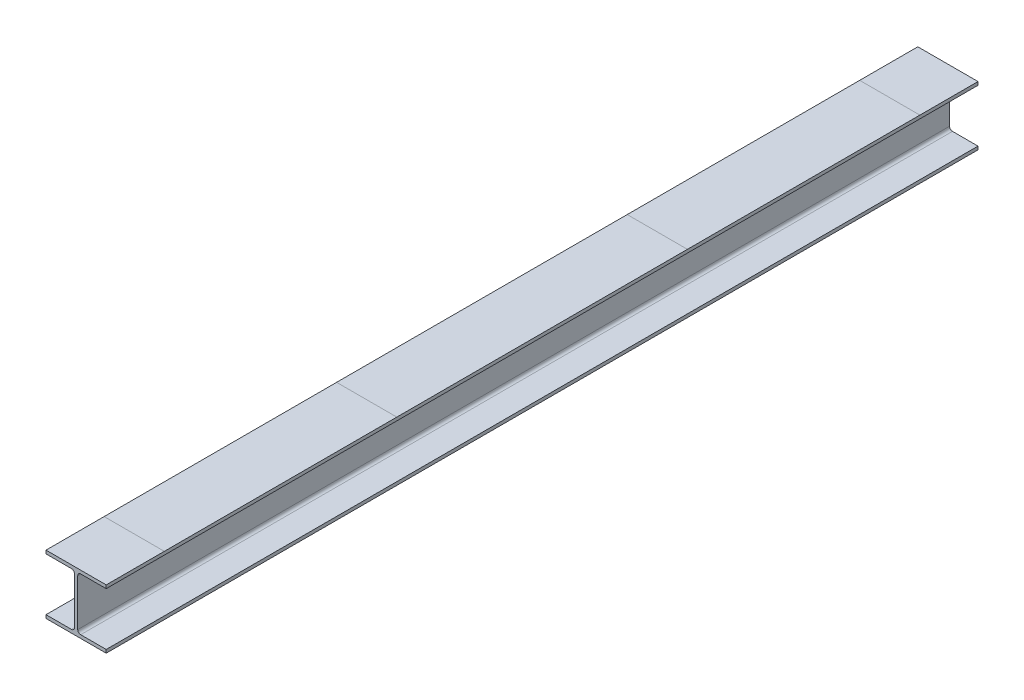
SolidWorks part; units mm, degrees
ref_plane "Alzado" through (0, 0, 0) normal (0, 0, 1) x (1, 0, 0)
ref_plane "Planta" through (0, 0, 0) normal (0, 1, 0) x (1, 0, 0)
ref_plane "Vista lateral" through (0, 0, 0) normal (1, 0, 0) x (0, 0, -1)
sketch "Croquis1" plane through (0, 0, 0) normal (0, 0, 1) x (1, 0, 0)
  line L0 (-81.28, -8.763) -> (-81.28, 2.54)
  line L1 (-81.28, 2.54) -> (6.477, 2.54)
  line L2 (16.637, 12.7) -> (16.637, 173.482)
  line L3 (6.477, 183.642) -> (-81.28, 183.642)
  line L4 (-81.28, 183.642) -> (-81.28, 194.945)
  line L5 (-81.28, 194.945) -> (125.857, 194.945)
  line L6 (125.857, 194.945) -> (125.857, 183.642)
  line L7 (125.857, 183.642) -> (38.1, 183.642)
  line L8 (27.94, 173.482) -> (27.94, 12.7)
  line L9 (38.1, 2.54) -> (125.857, 2.54)
  line L10 (125.857, 2.54) -> (125.857, -8.763)
  line L11 (125.857, -8.763) -> (-81.28, -8.763)
  arc A0 (6.477, 2.54) -> (16.637, 12.7) centre (6.477, 12.7) ccw
  arc A1 (16.637, 173.482) -> (6.477, 183.642) centre (6.477, 173.482) ccw
  arc A2 (38.1, 183.642) -> (27.94, 173.482) centre (38.1, 173.482) ccw
  arc A3 (27.94, 12.7) -> (38.1, 2.54) centre (38.1, 12.7) ccw
extrude "Extruir1" add sketch "Croquis1" along normal blind 3000
sketch "Croquis2" plane through (0, 194.945, 0) normal (0, 1, 0) x (1, 0, 0)
  line L0 (-271.6324, -1000) -> (-271.6324, -2000)
  line L1 (328.8966, -2000) -> (-271.6324, -2000)
  line L2 (328.8966, -1000) -> (-271.6324, -1000)
  line L3 (328.8966, -1000) -> (328.8966, -2000)
sketch "Croquis4" plane through (0, 194.945, 0) normal (0, 1, 0) x (1, 0, 0)
  line L0 (-385.8175, -200) -> (679.9101, -200)
  line L2 (125.857, 0) -> (-81.28, 0) construction
  dimension "D1" = 200
sketch "Croquis5" plane through (0, -8.763, 0) normal (0, -1, 0) x (1, 0, 0)
  line L0 (-449.2537, 2000) -> (-449.2537, 1000)
  line L1 (-449.2537, 1000) -> (591.0995, 1000)
  line L2 (-449.2537, 2000) -> (591.0995, 2000)
  line L3 (591.0995, 2000) -> (591.0995, 1000)
sketch "Croquis3" plane through (0, 194.945, 0) normal (0, 1, 0) x (-1, 0, 0)
  line L0 (301.236, 2800) -> (332.4315, 3294.9868)
  line L2 (301.236, 2800) -> (-451.5399, 2800)
  line L4 (332.4315, 3294.9868) -> (-744.8145, 3543.8127)
  line L5 (-744.8145, 3543.8127) -> (-451.5399, 2800)
